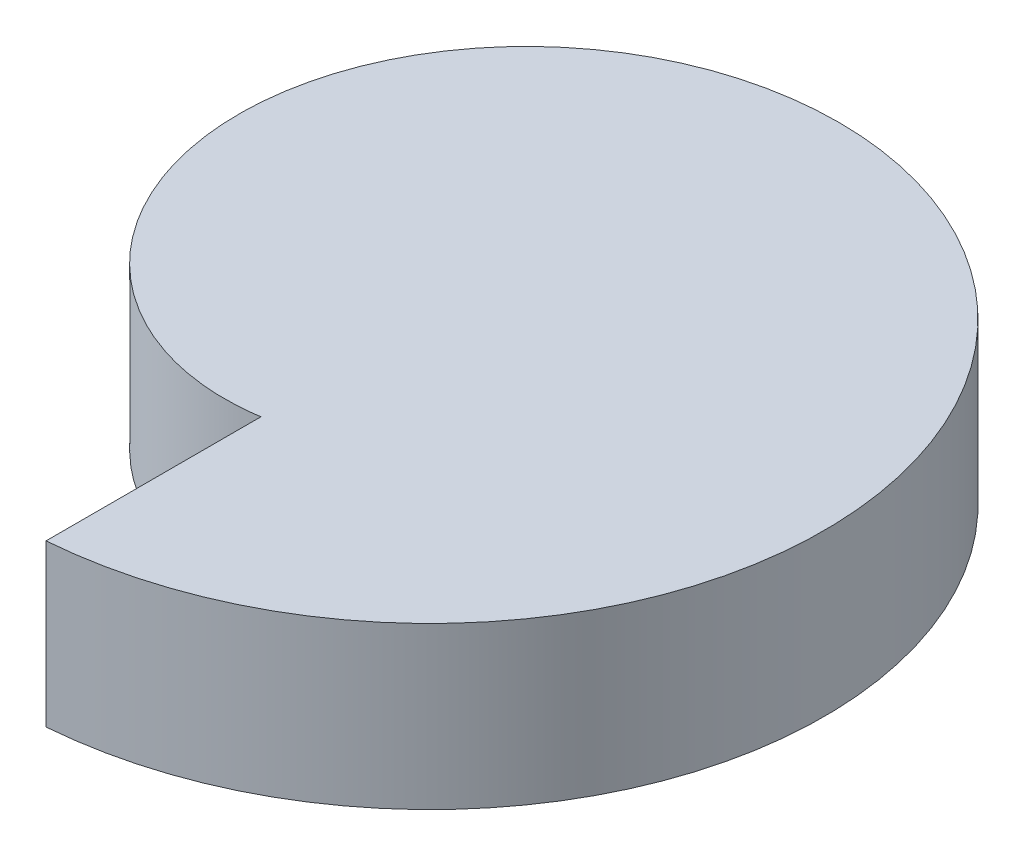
SolidWorks part; units mm, degrees
ref_plane "Front Plane" through (0, 0, 0) normal (0, 0, 1) x (1, 0, 0)
ref_plane "Top Plane" through (0, 0, 0) normal (0, 1, 0) x (1, 0, 0)
ref_plane "Right Plane" through (0, 0, 0) normal (1, 0, 0) x (0, 0, -1)
sketch "Sketch1" plane through (0, 0, 0) normal (0, 1, 0) x (1, 0, 0)
  circle A0 centre (0, 0) radius 40.45
  dimension "D1" = 80.9
curve "Helix/Spiral1"
sketch "Sketch3" plane through (0, 0, 0) normal (0, 1, 0) x (1, 0, 0)
  line L0 (0, -40.45) -> (0, -80.45)
  spline S0 degree 3 number of poles 66 (0, -40.45) -> (0, -80.45) construction
  spline S1 degree 3 number of poles 66 (0, -40.45) -> (0, -80.45)
extrude "Boss-Extrude1" add sketch "Sketch3" along normal blind 30
